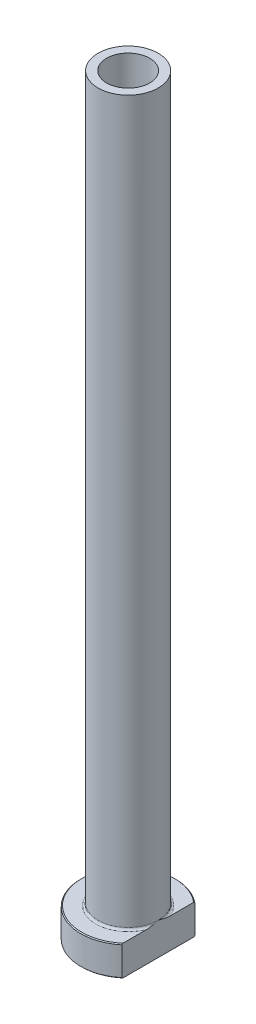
SolidWorks part; units mm, degrees
ref_plane "Front Plane" through (0, 0, 0) normal (0, 0, 1) x (1, 0, 0)
ref_plane "Top Plane" through (0, 0, 0) normal (0, 1, 0) x (1, 0, 0)
ref_plane "Right Plane" through (0, 0, 0) normal (1, 0, 0) x (0, 0, -1)
sketch "Sketch1" plane through (0, 0, 0) normal (0, 0, 1) x (1, 0, 0)
  line L0 (-5, 175) -> (-7, 175)
  line L1 (-7, 175) -> (-7, 7)
  line L2 (-7, 7) -> (-11, 7)
  line L3 (-11, 7) -> (-11, 0)
  line L4 (9.9, 0) -> (-9.9, 0) construction
  line L5 (-11, 0) -> (-5.25, 0)
  line L6 (-5, 130) -> (-5, 175)
  line L7 (0, 92.1877) -> (0, -15.5353) construction
  line L8 (0, -12.1) -> (0, 12.1) construction
  line L9 (-5, 130) -> (-5.25, 118)
  line L10 (-5.25, 118) -> (-5.25, 0)
  dimension "D1" = 0.25
  dimension "ID" = 10
  dimension "OD" = 14
  dimension "L" = 175
  dimension "H" = 22
  dimension "T" = 7
  dimension "N" = 45
  dimension "D2" = 12
  dimension "L-N" = 130
revolve "Revolve1" add sketch "Sketch1" angle 360 about L7
fillet "Fillet1" radius 0.5 1 edges at (0, 7, 7)
chamfer "Chamfer1" distance 0.2 angle 45 2 edges at (0, 7, 11) (0, 0, 11)
sketch "Sketch2" plane through (0, 0, 0) normal (0, -1, 0) x (1, 0, 0)
  line L0 (7, 8.4853) -> (7, -8.4853)
  circle A0 centre (0, 0) radius 11 construction
  arc A1 (7, 8.4853) -> (7, -8.4853) centre (0, 0) cw
  circle A2 centre (0, 0) radius 7 construction
extrude "Cut-Extrude1" cut sketch "Sketch2" against normal through all
chamfer "Chamfer2" distance 0.5 angle 45 1 edges at (0, 0, 5.25)
